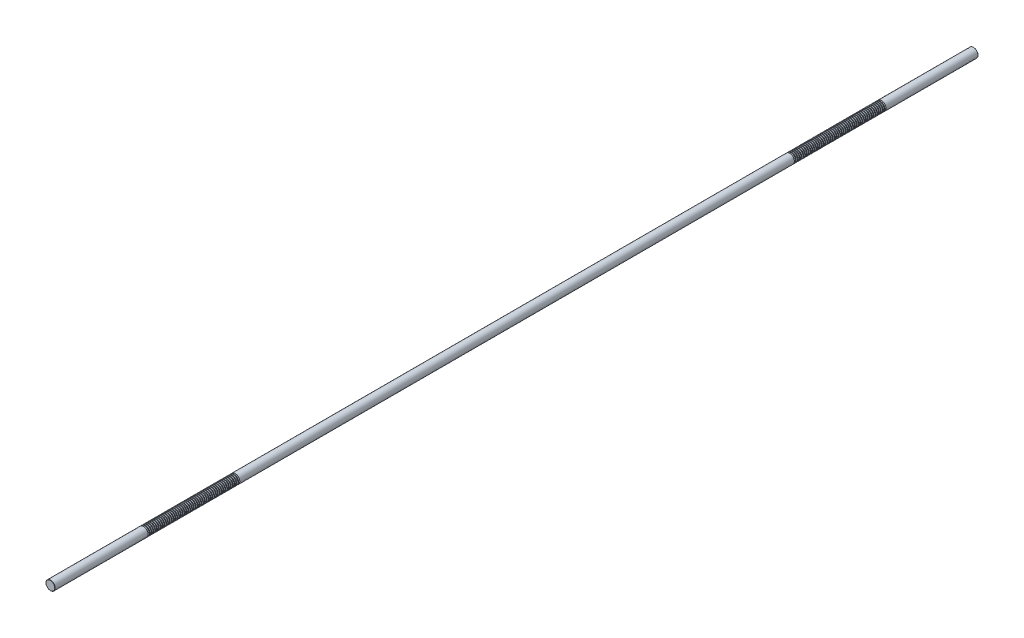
SolidWorks part; units mm, degrees
ref_plane "Front Plane" through (0, 0, 0) normal (0, 0, 1) x (1, 0, 0)
ref_plane "Top Plane" through (0, 0, 0) normal (0, 1, 0) x (1, 0, 0)
ref_plane "Right Plane" through (0, 0, 0) normal (1, 0, 0) x (0, 0, -1)
sketch "Sketch1" plane through (0, 0, 0) normal (0, 0, 1) x (1, 0, 0)
  circle A0 centre (0, 0) radius 5
  dimension "D1" = 10
extrude "Boss-Extrude1" add sketch "Sketch1" along normal mid plane 1000
chamfer "Chamfer1" distance 0.25 angle 45 2 edges at (5, 0, -500) (5, 0, 500)
sketch "Sketch2" plane through (0, 0, 0) normal (1, 0, 0) x (0, 0, -1)
  line L0 (400.1675, 5) -> (398.8325, 5)
  line L1 (499.75, 5) -> (-499.75, 5) construction
  line L2 (398.8325, 5) -> (399.1675, 3.75)
  line L3 (399.1675, 3.75) -> (399.8325, 3.75)
  line L4 (399.8325, 3.75) -> (400.1675, 5)
  line L5 (500, -4.75) -> (500, 4.75) construction
  point P4 (399.5, 5)
  point P7 (399.5, 3.75)
  point P8 (400, 4.375)
  point P9 (399, 4.375)
  dimension "D1" = 1
  dimension "D2" = 100
  dimension "D3" = 1.25
  dimension "D4" = 30
revolve "Cut-Revolve1" cut sketch "Sketch2" angle 360 about axis through (0, 0, 500) along (0, 0, -1)
pattern_linear "LPattern1" count 50 spacing 2 along (0, 0, 1) of "Cut-Revolve1"
pattern_linear "LPattern2" count 2 spacing 700 along (0, 0, 1) of "Cut-Revolve1", "LPattern1"
